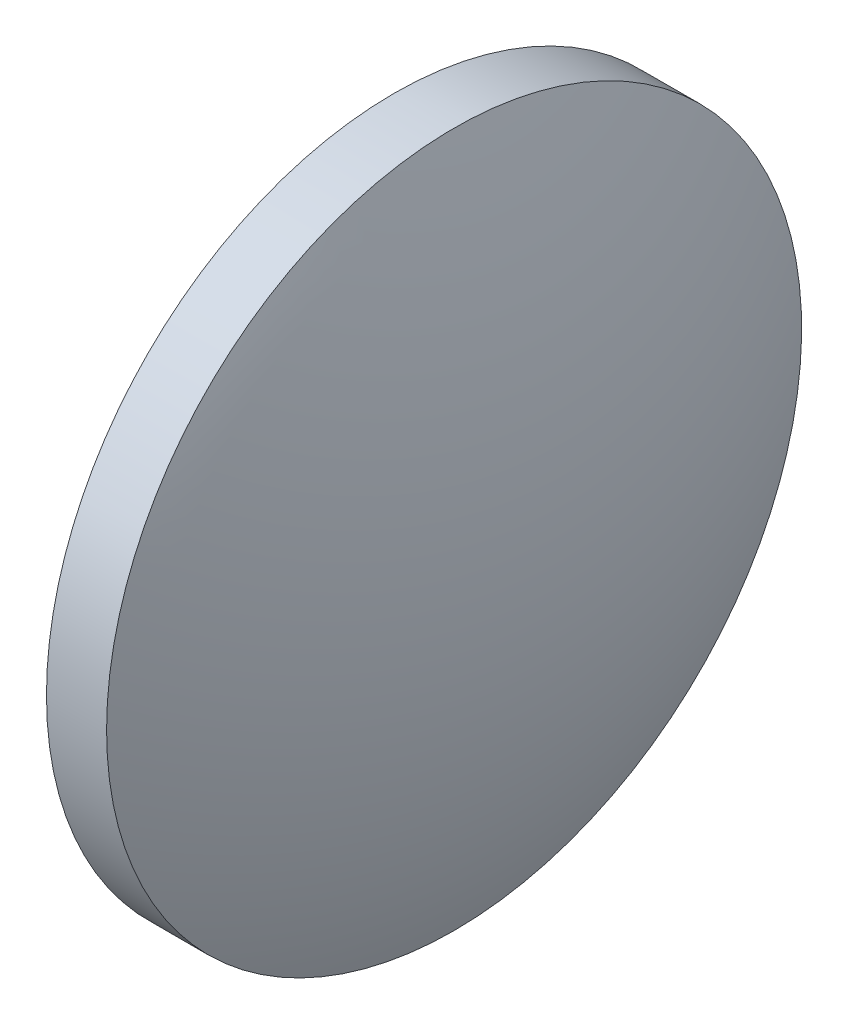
SolidWorks part; units mm, degrees
ref_plane "Front Plane" through (0, 0, 0) normal (0, 0, 1) x (1, 0, 0)
ref_plane "Top Plane" through (0, 0, 0) normal (0, 1, 0) x (1, 0, 0)
ref_plane "Right Plane" through (0, 0, 0) normal (1, 0, 0) x (0, 0, -1)
sketch "Sketch1" plane through (0, 0, 0) normal (0, 0, 1) x (1, 0, 0)
  line L1 (1.3, 9.25) -> (2.9, 9.25)
  line L3 (2.9, -9.25) -> (1.3, -9.25)
  line L5 (-1.7706, 0) -> (7.9563, 0) construction
  arc A0 (1.3, 9.25) -> (1.3, -9.25) centre (33.5587, 0) ccw
  arc A1 (2.9, 9.25) -> (2.9, -9.25) centre (-18.6664, 0) cw
revolve "Revolve1" add sketch "Sketch1" angle 360 about L5
